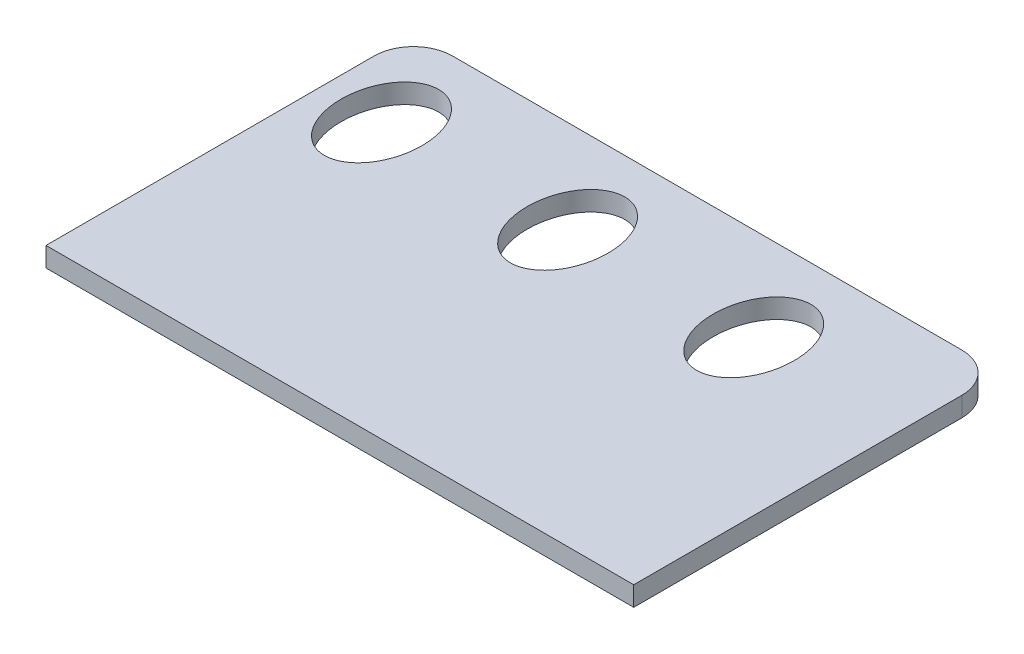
SolidWorks part; units mm, degrees
ref_plane "Ebene vorne" through (0, 0, 0) normal (0, 0, 1) x (1, 0, 0)
ref_plane "Ebene oben" through (0, 0, 0) normal (0, 1, 0) x (1, 0, 0)
ref_plane "Ebene rechts" through (0, 0, 0) normal (1, 0, 0) x (0, 0, -1)
sketch "Skizze1" plane through (0, 0, 0) normal (0, 1, 0) x (1, 0, 0)
  line L0 (0, 75.8471) -> (0, -85.9167) construction
  line L1 (-93.3877, 0) -> (97.9353, 0) construction
  line L2 (-60, 18.5) -> (60, 18.5) construction
  line L3 (-52, 37.5) -> (52, 37.5)
  line L4 (-60, 29.5) -> (-60, -37.5)
  line L5 (-60, -37.5) -> (60, -37.5)
  line L6 (60, 29.5) -> (60, -37.5)
  arc A0 (52, 37.5) -> (60, 29.5) centre (52, 29.5) cw
  arc A1 (-52, 37.5) -> (-60, 29.5) centre (-52, 29.5) ccw
  ellipse E0 centre (-47.5, 18.5) end of major axis (-47.5, 6.8327) minor radius 8.25
  ellipse E2 centre (-9.5, 18.5) end of major axis (-9.5, 6.8327) minor radius 8.25
  ellipse E3 centre (28.5, 18.5) end of major axis (28.5, 6.8327) minor radius 8.25
  point P19 (60, 37.5)
  point P22 (-60, 37.5)
  dimension "D13" = 8
  dimension "D1" = 120
  dimension "D2" = 75
  dimension "D3" = 16.5
  dimension "D4" = 23.3345
  dimension "D5" = 9.5
  dimension "D6" = 56
  dimension "D7" = 38
  dimension "D8" = 38
  dimension "D9" = 16.5
  dimension "D10" = 16.5
  dimension "D11" = 23.3345
  dimension "D12" = 23.3345
extrude "Aufsatz-Linear austragen1" add sketch "Skizze1" along normal blind 4
